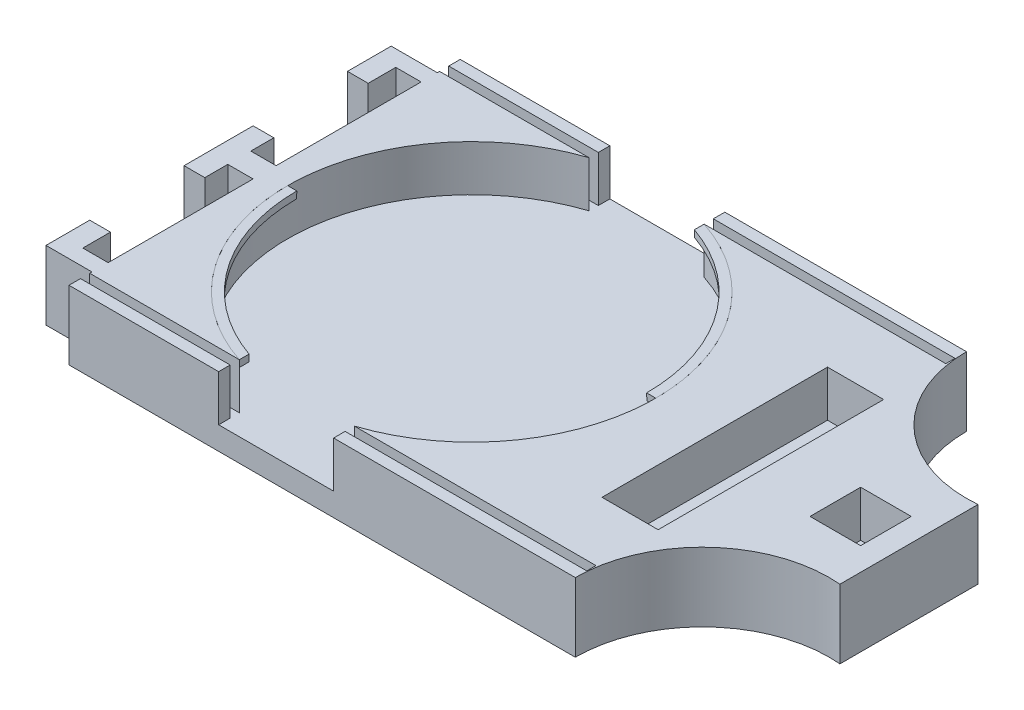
SolidWorks part; units mm, degrees
ref_plane "Alzado" through (0, 0, 0) normal (0, 0, 1) x (1, 0, 0)
ref_plane "Planta" through (0, 0, 0) normal (0, 1, 0) x (1, 0, 0)
ref_plane "Vista lateral" through (0, 0, 0) normal (1, 0, 0) x (0, 0, -1)
sketch "Croquis2" plane through (0, 0, 0) normal (0, 1, 0) x (1, 0, 0)
  line L0 (10, -80) -> (0, -80)
  line L1 (0, 0) -> (0, -85) construction
  line L2 (10, -85) -> (10, -80)
  line L3 (0, -80) -> (0, -70.5)
  line L4 (0, -70.5) -> (4.5, -70.5)
  line L5 (4.5, -70.5) -> (4.5, -76.5)
  line L6 (4.5, -76.5) -> (10, -76.5)
  line L7 (10, -76.5) -> (10, -45)
  line L8 (10, -45) -> (4.5, -45)
  line L9 (10, -40) -> (4.5, -40)
  line L10 (4.5, -45) -> (4.5, -50)
  line L11 (0, 0) -> (10, 0) construction
  line L12 (10, 0) -> (10, -5)
  line L13 (10, -5) -> (0, -5)
  line L14 (0, -5) -> (0, -14.5)
  line L15 (0, -14.5) -> (4.5, -14.5)
  line L16 (4.5, -14.5) -> (4.5, -8.5)
  line L17 (4.5, -8.5) -> (10, -8.5)
  line L18 (10, -8.5) -> (10, -40)
  line L19 (4.5, -40) -> (4.5, -35)
  line L20 (4.5, -50) -> (0, -50)
  line L21 (0, -50) -> (0, -35)
  line L22 (0, -35) -> (4.5, -35)
  line L23 (10, -85) -> (120, -85)
  line L24 (10, 0) -> (120, 0)
  line L26 (120, -85) -> (120, -42.5) construction
  line L27 (120, -42.5) -> (150, -42.5) construction
  line L28 (150, -42.5) -> (150, -57.5)
  line L29 (150, -42.5) -> (150, -27.5)
  arc A0 (120, -85) -> (150, -57.5) centre (147.6042, -85) cw
  arc A1 (120, 0) -> (150, -27.5) centre (147.6042, 0) ccw
  point P27 (7.25, -40)
  dimension "D1" = 85
  dimension "D2" = 9.5
  dimension "D3" = 31.5
  dimension "D4" = 15
  dimension "D5" = 10
  dimension "D6" = 4.5
  dimension "D7" = 5
  dimension "D8" = 5.5
  dimension "D9" = 10
  dimension "D10" = 110
extrude "Saliente-Extruir1" add sketch "Croquis2" along normal blind 15
sketch "Croquis3" plane through (0, 15, 0) normal (0, 1, 0) x (1, 0, 0)
  line L0 (10, -85) -> (10, -82.5) construction
  line L1 (10, -80) -> (10, -85) construction
  line L2 (10, -82.5) -> (10, -80.5)
  line L3 (10, -82.5) -> (42.51, -82.5)
  line L4 (120, -85) -> (120, 0) construction
  line L5 (10, -80.5) -> (42.51, -80.5)
  line L6 (120, -80.5) -> (120, -82.5)
  line L7 (10, 0) -> (10, -2.5) construction
  line L8 (10, 0) -> (10, -5) construction
  line L9 (10, -2.5) -> (42.51, -2.5)
  line L10 (10, -2.5) -> (10, -4.5)
  line L11 (10, -4.5) -> (42.51, -4.5)
  line L12 (120, -4.5) -> (120, -2.5)
  line L13 (0, -42.5) -> (10, -42.5) construction
  line L14 (0, -35) -> (0, -50) construction
  line L15 (10, -45) -> (10, -40) construction
  line L16 (10, -42.5) -> (15, -42.5) construction
  line L17 (67.49, -80.5) -> (120, -80.5)
  line L18 (67.49, -4.5) -> (120, -4.5)
  line L19 (42.51, -82.5) -> (42.51, -85)
  line L20 (10, -85) -> (120, -85) construction
  line L21 (67.49, -82.5) -> (67.49, -85)
  line L22 (67.49, -85) -> (42.51, -85)
  line L23 (67.49, -82.5) -> (120, -82.5)
  line L24 (42.51, -2.5) -> (42.51, 0)
  line L25 (120, 0) -> (10, 0) construction
  line L26 (42.51, 0) -> (67.49, 0)
  line L27 (67.49, 0) -> (67.49, -2.5)
  line L28 (67.49, -2.5) -> (120, -2.5)
  line L29 (15, -42.5) -> (150, -42.5) construction
  line L30 (150, -57.5) -> (150, -27.5) construction
  line L31 (120, -85) -> (120, 0) construction
  line L32 (120, -42.5) -> (120, -67)
  line L33 (120, -42.5) -> (120, -18)
  line L34 (120, -67) -> (107.8, -67)
  line L35 (120, -18) -> (107.8, -18)
  line L36 (107.8, -18) -> (107.8, -67)
  line L38 (145, -42.5) -> (145, -48)
  line L39 (145, -42.5) -> (145, -37)
  line L40 (145, -48) -> (134, -48)
  line L41 (134, -48) -> (134, -37)
  line L42 (134, -37) -> (145, -37)
  arc A0 (67.49, -80.5) -> (67.49, -4.5) centre (55, -42.5) ccw
  arc A1 (42.51, -4.5) -> (42.51, -80.5) centre (55, -42.5) ccw
  dimension "D1" = 49
  dimension "D2" = 40
  dimension "D3" = 12.2
  dimension "D4" = 11
extrude "Cortar-Extruir1" cut sketch "Croquis3" against normal blind 10
sketch "Croquis4" plane through (0, 15, 0) normal (0, 1, 0) x (1, 0, 0)
  line L0 (93, -42.5) -> (17, -42.5) construction
  line L1 (67.49, -4.5) -> (67.49, -6.6113)
  line L2 (93, -42.5) -> (95, -42.5)
  line L3 (42.51, -80.5) -> (42.51, -78.3887)
  line L4 (17, -42.5) -> (15, -42.5)
  arc A0 (67.49, -80.5) -> (67.49, -4.5) centre (55, -42.5) ccw construction
  arc A1 (42.51, -4.5) -> (42.51, -80.5) centre (55, -42.5) ccw construction
  arc A2 (93, -42.5) -> (67.49, -6.6113) centre (55, -42.5) ccw
  arc A3 (17, -42.5) -> (42.51, -78.3887) centre (55, -42.5) ccw
  arc A4 (95, -42.5) -> (67.49, -4.5) centre (55, -42.5) ccw
  arc A5 (15, -42.5) -> (42.51, -80.5) centre (55, -42.5) ccw
extrude "Saliente-Extruir2" add sketch "Croquis4" against normal blind 1.5 draft 1 separate body
